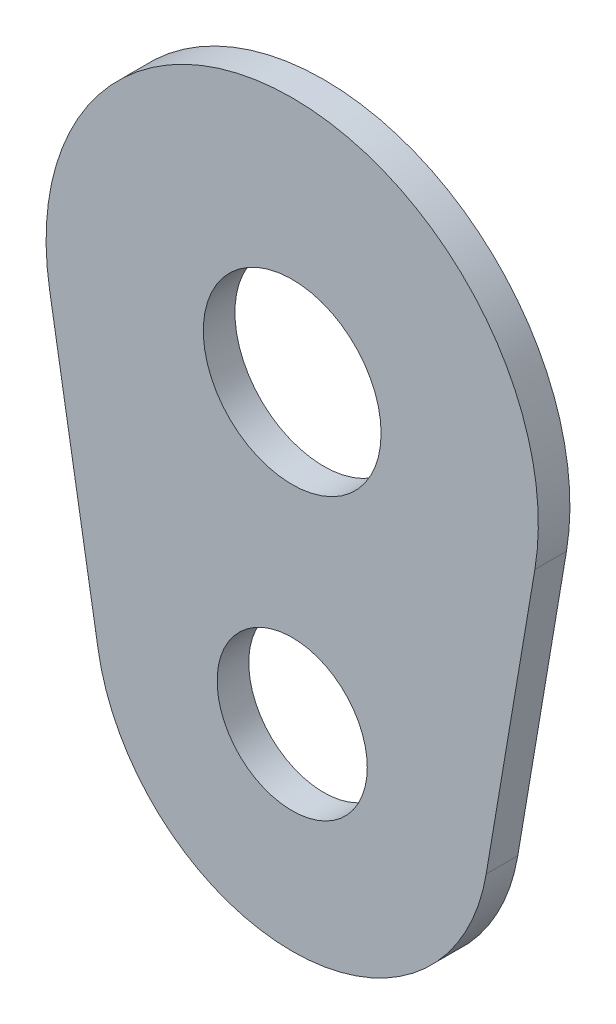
SolidWorks part; units mm, degrees
ref_plane "Front" through (0, 0, 0) normal (0, 0, 1) x (1, 0, 0)
ref_plane "Top" through (0, 0, 0) normal (0, 1, 0) x (1, 0, 0)
ref_plane "Right" through (0, 0, 0) normal (1, 0, 0) x (0, 0, -1)
sketch "Sketch1" plane through (0, 0, 0) normal (0, 0, 1) x (1, 0, 0)
  line L4 (-15.6009, -2.637) -> (-12.4703, -21.1579)
  line L5 (12.4703, -21.1579) -> (15.6009, -2.637)
  arc A4 (15.6009, -2.637) -> (-15.6009, -2.637) centre (0, 0) ccw
  arc A5 (-12.4703, -21.1579) -> (12.4703, -21.1579) centre (0, -19.05) ccw
  dimension "D1" = 15.8222
  dimension "D2" = 12.6472
  dimension "D3" = 19.05
extrude "Extrude1" add sketch "Sketch1" along normal blind 2.032
sketch "Sketch2" plane through (0, 0, 2.032) normal (0, 0, 1) x (1, 0, 0)
  circle A1 centre (0, -19.05) radius 4.826
  dimension "D1" = 9.652
extrude "Cut-Extrude1" cut sketch "Sketch2" against normal through all
sketch "Sketch3" plane through (0, 0, 2.032) normal (0, 0, 1) x (1, 0, 0)
  circle A0 centre (0, 0) radius 5.715
  dimension "D1" = 11.43
extrude "Cut-Extrude2" cut sketch "Sketch3" against normal through all
